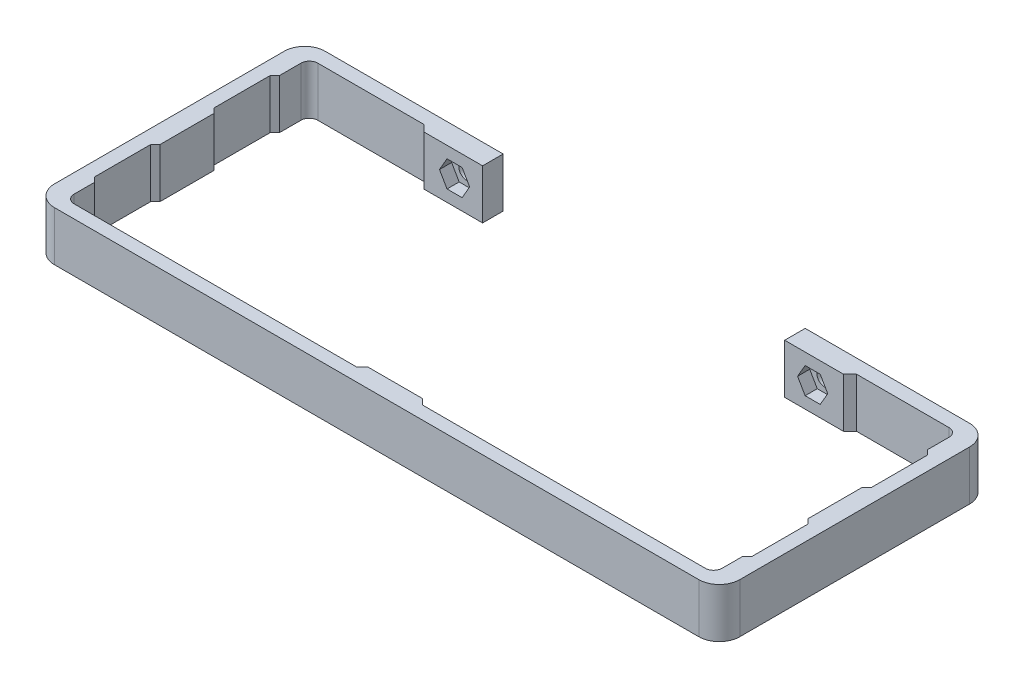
SolidWorks part; units mm, degrees
ref_plane "Front Plane" through (0, 0, 0) normal (0, 0, 1) x (1, 0, 0)
ref_plane "Top Plane" through (0, 0, 0) normal (0, 1, 0) x (1, 0, 0)
ref_plane "Right Plane" through (0, 0, 0) normal (1, 0, 0) x (0, 0, -1)
sketch "Sketch1" plane through (0, 0, 0) normal (0, 0, 1) x (1, 0, 0)
  line L1 (-25.4026, 47.8166) -> (121.3974, 47.8166)
  line L2 (-25.4026, 47.8166) -> (-25.4026, 37.2166)
  line L3 (-25.4026, 37.2166) -> (121.3974, 37.2166)
  line L4 (121.3974, 47.8166) -> (121.3974, 37.2166)
  dimension "D1" = 146.8
  dimension "D2" = 10.6
extrude "Boss-Extrude1" add sketch "Sketch1" along normal blind 4
ref_plane "Plane1" through (0, 0, 0) normal (0, 0, -1) x (-1, 0, 0)
sketch "Sketch2" plane through (0, 0, 0) normal (0, 0, -1) x (-1, 0, 0)
  line L0 (-121.3974, 47.8166) -> (25.4026, 47.8166) construction
  line L1 (-121.3974, 37.2166) -> (-117.3974, 37.2166)
  line L2 (-121.3974, 37.2166) -> (-121.3974, 47.8166)
  line L3 (-121.3974, 47.8166) -> (-117.3974, 47.8166)
  line L4 (-117.3974, 37.2166) -> (-117.3974, 47.8166)
  line L6 (25.4026, 37.2166) -> (21.4026, 37.2166)
  line L7 (25.4026, 37.2166) -> (25.4026, 47.8166)
  line L8 (25.4026, 47.8166) -> (21.4026, 47.8166)
  line L9 (21.4026, 37.2166) -> (21.4026, 47.8166)
  dimension "D1" = 4
  dimension "D2" = 4
extrude "Boss-Extrude2" add sketch "Sketch2" along normal blind 54
ref_plane "Plane2" through (0, 47.8166, 0) normal (0, 1, 0) x (1, 0, 0)
sketch "Sketch3" plane through (0, 47.8166, 0) normal (0, 1, 0) x (1, 0, 0)
  line L1 (-21.4026, 54) -> (17.0974, 54)
  line L2 (-21.4026, 54) -> (-21.4026, 49.6)
  line L3 (-21.4026, 49.6) -> (17.0974, 49.6)
  line L4 (17.0974, 54) -> (17.0974, 49.6)
  line L5 (117.3974, 54) -> (81.7974, 54)
  line L6 (117.3974, 54) -> (117.3974, 49.6)
  line L7 (117.3974, 49.6) -> (81.7974, 49.6)
  line L8 (81.7974, 54) -> (81.7974, 49.6)
  dimension "D1" = 4.4
  dimension "D2" = 4.4
  dimension "D3" = 38.5
  dimension "D4" = 35.6
extrude "Boss-Extrude3" add sketch "Sketch3" against normal blind 10.6
fillet "Fillet1" radius 4.4 4 edges at (121.3974, 42.5166, -54) (-25.4026, 42.5166, -54) (-25.4026, 42.5166, 4) (121.3974, 42.5166, 4)
ref_plane "Plane3" through (0, 0, -54) normal (0, 0, -1) x (-1, 0, 0)
sketch "Sketch4" plane through (0, 0, -54) normal (0, 0, -1) x (-1, 0, 0)
  line L0 (-17.0974, 37.2166) -> (-17.0974, 47.8166) construction
  line L1 (21.0026, 47.8166) -> (-17.0974, 47.8166) construction
  line L2 (-81.7974, 47.8166) -> (-116.9974, 47.8166) construction
  line L3 (-81.7974, 37.2166) -> (-81.7974, 47.8166) construction
  circle A0 centre (-11.0974, 42.5166) radius 1.7
  circle A1 centre (-87.7974, 42.5166) radius 1.7
  point P6 (0, 0)
  point P11 (0, 0)
  dimension "D1" = 3.4
  dimension "D2" = 3.4
  dimension "D3" = 6
  dimension "D4" = 5.3
  dimension "D5" = 5.3
  dimension "D6" = 6
extrude "Cut-Extrude1" cut sketch "Sketch4" against normal blind 10.6
ref_plane "Plane4" through (0, 0, -49.6) normal (0, 0, 1) x (1, 0, 0)
sketch "Sketch5" plane through (0, 0, -49.6) normal (0, 0, 1) x (1, 0, 0)
  line L1 (12.714, 39.7166) -> (14.3305, 42.5166)
  line L2 (14.3305, 42.5166) -> (12.714, 45.3166)
  line L3 (12.714, 45.3166) -> (9.4808, 45.3166)
  line L4 (9.4808, 45.3166) -> (7.8642, 42.5166)
  line L5 (7.8642, 42.5166) -> (9.4808, 39.7166)
  line L6 (9.4808, 39.7166) -> (12.714, 39.7166)
  line L7 (89.414, 39.7166) -> (91.0305, 42.5166)
  line L8 (91.0305, 42.5166) -> (89.414, 45.3166)
  line L9 (89.414, 45.3166) -> (86.1808, 45.3166)
  line L10 (86.1808, 45.3166) -> (84.5642, 42.5166)
  line L11 (84.5642, 42.5166) -> (86.1808, 39.7166)
  line L12 (86.1808, 39.7166) -> (89.414, 39.7166)
  circle A0 centre (11.0974, 42.5166) radius 2.8 construction
  circle A1 centre (87.7974, 42.5166) radius 2.8 construction
  dimension "D1" = 5.6
  dimension "D2" = 5.6
extrude "Cut-Extrude2" cut sketch "Sketch5" against normal blind 2.6
sketch "Sketch6" plane through (0, 47.8166, 0) normal (0, 1, 0) x (1, 0, 0)
  line L0 (121.3974, 0.4) -> (121.3974, 49.6) construction
  line L1 (117.3974, 4) -> (118.3974, 4)
  line L2 (117.3974, 4) -> (117.3974, 20)
  line L3 (117.3974, 20) -> (118.3974, 20)
  line L4 (118.3974, 4) -> (118.3974, 20)
  line L5 (117.3974, 45.6) -> (118.3974, 45.6)
  line L6 (117.3974, 45.6) -> (117.3974, 29.6)
  line L7 (117.3974, 29.6) -> (118.3974, 29.6)
  line L8 (118.3974, 45.6) -> (118.3974, 29.6)
  line L9 (117.3974, 49.6) -> (117.3974, 0) construction
  line L10 (-21.4026, 4) -> (-22.4026, 4)
  line L11 (-21.4026, 4) -> (-21.4026, 20)
  line L12 (-21.4026, 20) -> (-22.4026, 20)
  line L13 (-22.4026, 4) -> (-22.4026, 20)
  line L14 (-21.4026, 45.6) -> (-22.4026, 45.6)
  line L15 (-21.4026, 45.6) -> (-21.4026, 29.6)
  line L16 (-21.4026, 29.6) -> (-22.4026, 29.6)
  line L17 (-22.4026, 45.6) -> (-22.4026, 29.6)
  line L18 (-21.4026, 49.6) -> (-21.4026, 0) construction
  line L19 (117.3974, 0) -> (-21.4026, 0) construction
  line L20 (81.7974, 49.6) -> (117.3974, 49.6) construction
  line L21 (-25.4026, 0.4) -> (-25.4026, 49.6) construction
  line L22 (-21.4026, 49.6) -> (17.0974, 49.6) construction
  point P21 (0, 0)
  point P22 (117.3974, 1.7594)
  point P26 (0, 0)
  point P27 (-21.4026, 3.1177)
  point P30 (0, 0)
  point P31 (-21.4026, 47.4881)
  point P32 (117.8974, 4)
  point P35 (0, 0)
  point P38 (117.3974, 35.7441)
  dimension "D1" = 3
  dimension "D2" = 3
  dimension "D3" = 4
  dimension "D4" = 16
  dimension "D5" = 4
  dimension "D6" = 16
  dimension "D7" = 4
  dimension "D8" = 3
  dimension "D9" = 3
  dimension "D10" = 4
  dimension "D11" = 16
  dimension "D12" = 16
extrude "Cut-Extrude3" cut sketch "Sketch6" against normal blind 13.6
sketch "Sketch7" plane through (0, 47.8166, 0) normal (0, 1, 0) x (1, 0, 0)
  line L0 (116.9974, -4) -> (-21.0026, -4) construction
  line L1 (117.3974, 0) -> (52.9974, 0)
  line L2 (117.3974, 0) -> (117.3974, -1.2)
  line L3 (117.3974, -1.2) -> (52.9974, -1.2)
  line L4 (52.9974, 0) -> (52.9974, -1.2)
  line L5 (-21.4026, 0) -> (42.9974, 0)
  line L6 (-21.4026, 0) -> (-21.4026, -1.2)
  line L7 (-21.4026, -1.2) -> (42.9974, -1.2)
  line L8 (42.9974, 0) -> (42.9974, -1.2)
  line L9 (-21.0026, 54) -> (17.0974, 54) construction
  line L10 (117.3974, 49.6) -> (93.7974, 49.6)
  line L11 (117.3974, 49.6) -> (117.3974, 51)
  line L12 (117.3974, 51) -> (93.7974, 51)
  line L13 (93.7974, 49.6) -> (93.7974, 51)
  line L14 (-21.4026, 49.6) -> (5.0974, 49.6)
  line L15 (-21.4026, 49.6) -> (-21.4026, 51)
  line L16 (-21.4026, 51) -> (5.0974, 51)
  line L17 (5.0974, 49.6) -> (5.0974, 51)
  line L18 (81.7974, 54) -> (116.9974, 54) construction
  line L19 (81.7974, 54) -> (81.7974, 49.6) construction
  line L20 (17.0974, 49.6) -> (17.0974, 54) construction
  point P26 (93.7974, 50.3)
  point P31 (17.0974, 51.8)
  dimension "D1" = 10
  dimension "D2" = 64.4
  dimension "D3" = 2.8
  dimension "D4" = 2.8
  dimension "D5" = 3
  dimension "D6" = 3
  dimension "D7" = 12
  dimension "D8" = 12
extrude "Cut-Extrude4" cut sketch "Sketch7" against normal blind 13.6
chamfer "Chamfer1" distance 2 angle 45 12 edges at (93.7974, 42.5166, -51) (5.0974, 42.5166, -51) (118.3974, 42.5166, -45.6) (118.3974, 42.5166, -4) (118.3974, 42.5166, -20) (118.3974, 42.5166, -29.6) (52.9974, 42.5166, 1.2) (42.9974, 42.5166, 1.2) (-22.4026, 42.5166, -20) (-22.4026, 42.5166, -4) (-22.4026, 42.5166, -29.6) (-22.4026, 42.5166, -45.6)
fillet "Fillet2" radius 1.8 4 edges at (117.3974, 42.5166, -51) (117.3974, 42.5166, 1.2) (-21.4026, 42.5166, -51) (-21.4026, 42.5166, 1.2)
